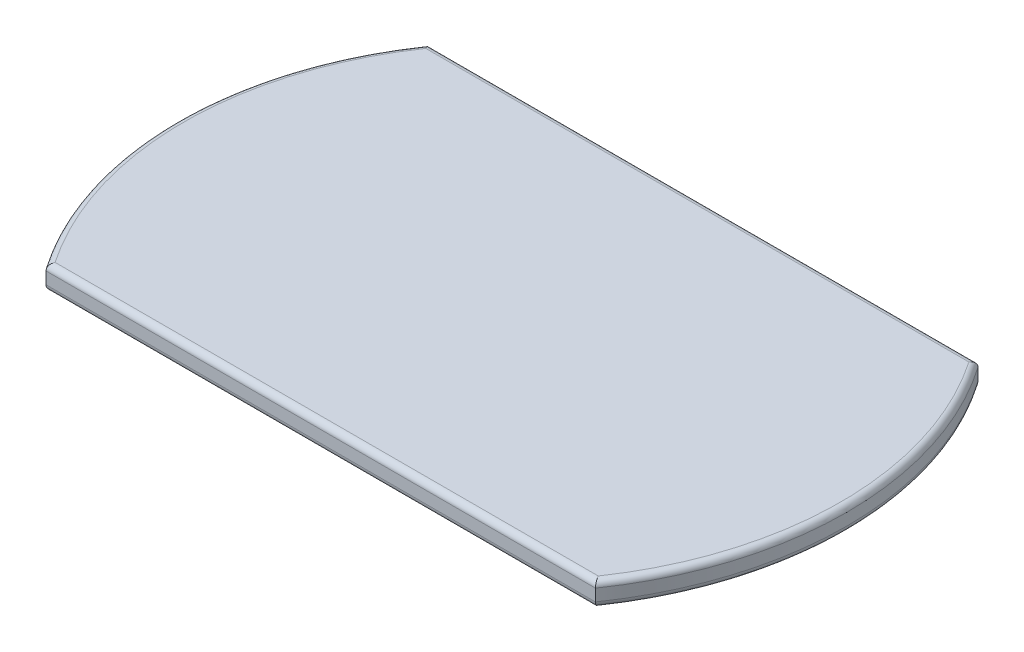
SolidWorks part; units mm, degrees
ref_plane "Front Plane" through (0, 0, 0) normal (0, 0, 1) x (1, 0, 0)
ref_plane "Top Plane" through (0, 0, 0) normal (0, 1, 0) x (1, 0, 0)
ref_plane "Right Plane" through (0, 0, 0) normal (1, 0, 0) x (0, 0, -1)
sketch "Sketch1" plane through (0, 0, 0) normal (0, 1, 0) x (1, 0, 0)
  line L1 (-145.9119, 101.6) -> (145.9119, 101.6)
  line L3 (-145.9119, -101.6) -> (145.9119, -101.6)
  arc A0 (-145.9119, 101.6) -> (-145.9119, -101.6) centre (0, 0) ccw
  arc A1 (145.9119, -101.6) -> (145.9119, 101.6) centre (0, 0) ccw
  dimension "D1" = 203.2
  dimension "D3" = 355.6
  dimension "D2" = 101.6
extrude "Extrude1" add sketch "Sketch1" against normal blind 12.7
fillet "Fillet1" radius 3.175 4 edges at (0, 0, -101.6) (177.8, 0, 0) (0, 0, 101.6) (-177.8, 0, 0)
fillet "Fillet2" radius 3.175 4 edges at (0, -12.7, 101.6) (177.8, -12.7, 0) (0, -12.7, -101.6) (-177.8, -12.7, 0)
